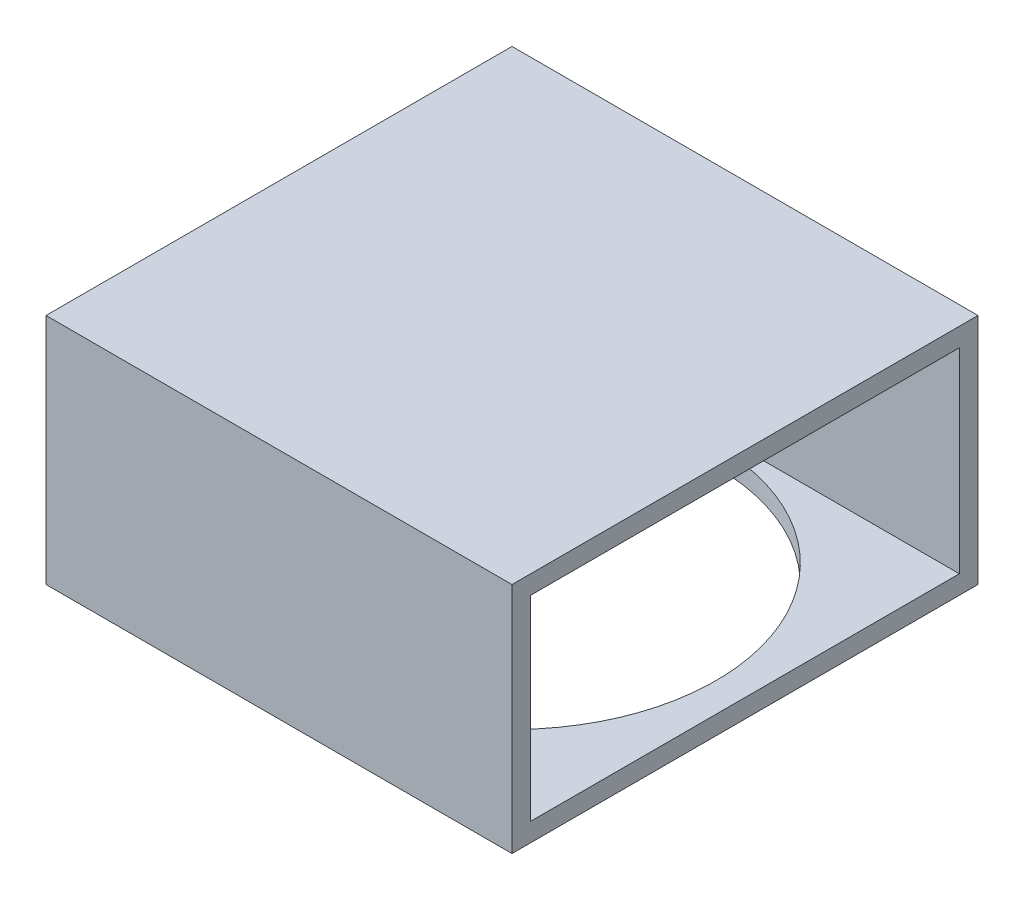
SolidWorks part; units mm, degrees
ref_plane "Front Plane" through (0, 0, 0) normal (0, 0, 1) x (1, 0, 0)
ref_plane "Top Plane" through (0, 0, 0) normal (0, 1, 0) x (1, 0, 0)
ref_plane "Right Plane" through (0, 0, 0) normal (1, 0, 0) x (0, 0, -1)
sketch "Sketch1" plane through (0, 0, 0) normal (1, 0, 0) x (0, 0, -1)
  line L1 (0, 0) -> (-100, 0)
  line L2 (0, 0) -> (0, -50)
  line L3 (0, -50) -> (-100, -50)
  line L4 (-100, 0) -> (-100, -50)
  line L5 (-96, -4) -> (-4, -4)
  line L6 (-96, -4) -> (-96, -46)
  line L7 (-96, -46) -> (-4, -46)
  line L8 (-4, -4) -> (-4, -46)
  dimension "D1" = 100
  dimension "D2" = 50
  dimension "D3" = 4
  dimension "D4" = 4
  dimension "D5" = 4
  dimension "D6" = 4
extrude "Boss-Extrude1" add sketch "Sketch1" along normal blind 100
sketch "Sketch2" plane through (0, -50, 0) normal (0, -1, 0) x (1, 0, 0)
  line L0 (100, 0) -> (100, 100) construction
  line L1 (23.75, 15) -> (76.25, 15) construction
  line L2 (23.75, 15) -> (23.75, 85) construction
  line L3 (23.75, 85) -> (76.25, 85) construction
  line L4 (76.25, 15) -> (76.25, 85) construction
  line L5 (23.75, 15) -> (76.25, 85) construction
  line L6 (23.75, 85) -> (76.25, 15) construction
  line L7 (100, 100) -> (0, 100) construction
  circle A0 centre (50, 50) radius 43.75
  point P6 (0, 0)
  point P7 (0, 0)
  point P8 (81.6938, 33.5612)
  point P11 (100, 50)
  point P14 (50, 100)
  dimension "D2" = 70
  dimension "D3" = 52.5
extrude "Cut-Extrude1" cut sketch "Sketch2" against normal up to next
